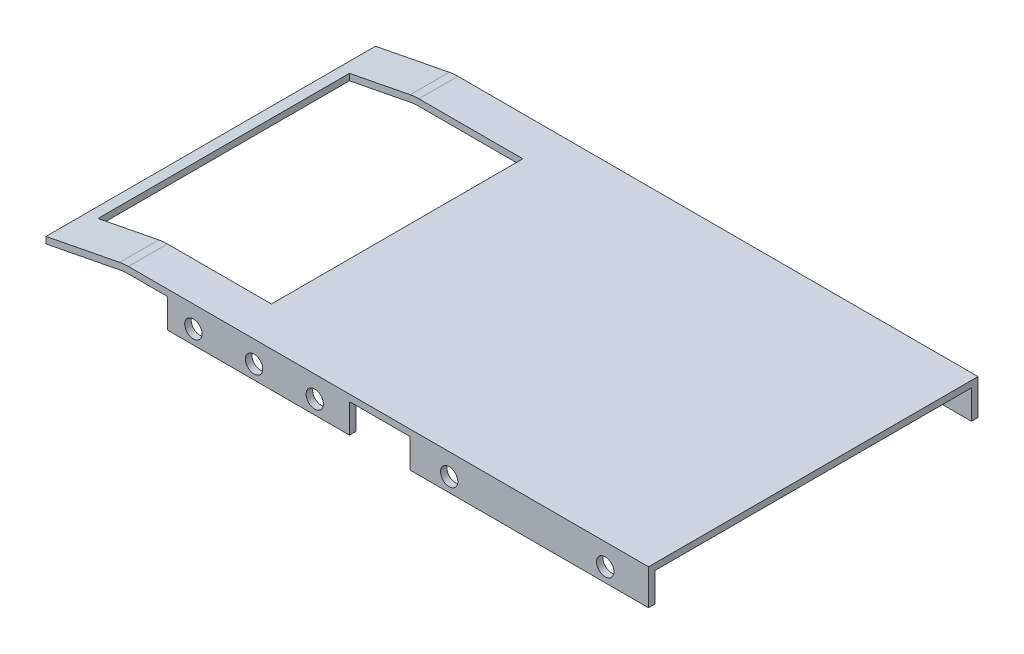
SolidWorks part; units mm, degrees
ref_plane "Face" through (0, 0, 0) normal (0, 0, 1) x (1, 0, 0)
ref_plane "Dessus" through (0, 0, 0) normal (0, 1, 0) x (1, 0, 0)
ref_plane "Droite" through (0, 0, 0) normal (1, 0, 0) x (0, 0, -1)
sketch "Esquisse1" plane through (0, 0, 0) normal (0, 0, 1) x (1, 0, 0)
  line L1 (0, 0) -> (121, 0)
  line L2 (0, 0) -> (0, 1.5)
  line L3 (0, 1.5) -> (121, 1.5)
  line L4 (121, 0) -> (121, 1.5)
  dimension "D1" = 1.5
  dimension "D2" = 121
extrude "Extrusion1" add sketch "Esquisse1" along normal mid plane 76
sketch "Esquisse2" plane through (0, 0, 0) normal (0, 0, 1) x (1, 0, 0)
  line L0 (0, 1.5) -> (-18, -2)
  line L1 (0, 0) -> (-18, -3.5)
  line L2 (-18, -2) -> (-18, -3.5)
  line L4 (0, 1.5) -> (0, 0)
  dimension "D1" = 18
  dimension "D2" = 3.5
  dimension "D3" = 18
extrude "Extrusion2" add sketch "Esquisse2" along normal mid plane 76
fillet "Congé2" radius 8.5 1 edges at (0, 0, 0)
sketch "Esquisse3" plane through (0, 0, 0) normal (0, -1, 0) x (1, 0, 0)
  line L0 (0.8187, -38) -> (121, -38) construction
  line L1 (121, -38) -> (66, -38)
  line L2 (121, -38) -> (121, -36.5)
  line L3 (121, -36.5) -> (66, -36.5)
  line L4 (66, -38) -> (66, -36.5)
  line L5 (52, -38) -> (10, -38)
  line L6 (52, -38) -> (52, -36.5)
  line L7 (52, -36.5) -> (10, -36.5)
  line L8 (10, -38) -> (10, -36.5)
  dimension "D1" = 55
  dimension "D2" = 1.5
  dimension "D3" = 1.5
  dimension "D4" = 14
  dimension "D5" = 42
extrude "Extrusion3" add sketch "Esquisse3" along normal blind 6.7
mirror "Symétrie1" about plane through (0, 0, 0) normal (0, 0, 1) of "Extrusion3"
sketch "Esquisse4" plane through (0, 0, 38) normal (0, 0, 1) x (1, 0, 0)
  line L0 (18.7479, -3.5) -> (124.5009, -3.5) construction
  line L1 (52, 0) -> (66, 0) construction
  line L2 (121, -6.7) -> (121, 1.5) construction
  circle A0 centre (30, -3.5) radius 2
  circle A1 centre (44, -3.5) radius 2
  circle A2 centre (75, -3.5) radius 2
  circle A3 centre (111, -3.5) radius 2
  circle A4 centre (16, -3.5) radius 2
  dimension "D2" = 10
  dimension "D3" = 36
  dimension "D4" = 67
  dimension "D5" = 81
  dimension "D6" = 4
  dimension "D7" = 4
  dimension "D8" = 4
  dimension "D9" = 4
  dimension "D10" = 4
  dimension "D11" = 95
  dimension "D1" = 3.5
extrude "Enlèv. mat.-Extru.1" cut sketch "Esquisse4" against normal through all
sketch "Esquisse5" plane through (0, 1.5, 0) normal (0, 1, 0) x (-1, 0, 0)
  line L1 (15, -29) -> (-25, -29)
  line L2 (15, -29) -> (15, 29)
  line L3 (15, 29) -> (-25, 29)
  line L4 (-25, -29) -> (-25, 29)
  dimension "D1" = 40
  dimension "D2" = 25
  dimension "D3" = 58
  dimension "D4" = 29
extrude "Enlèv. mat.-Extru.2" cut sketch "Esquisse5" against normal through all
fillet "Congé3" radius 10.5 2 edges at (0, 1.5, -33.5) (0, 1.5, 33.5)
